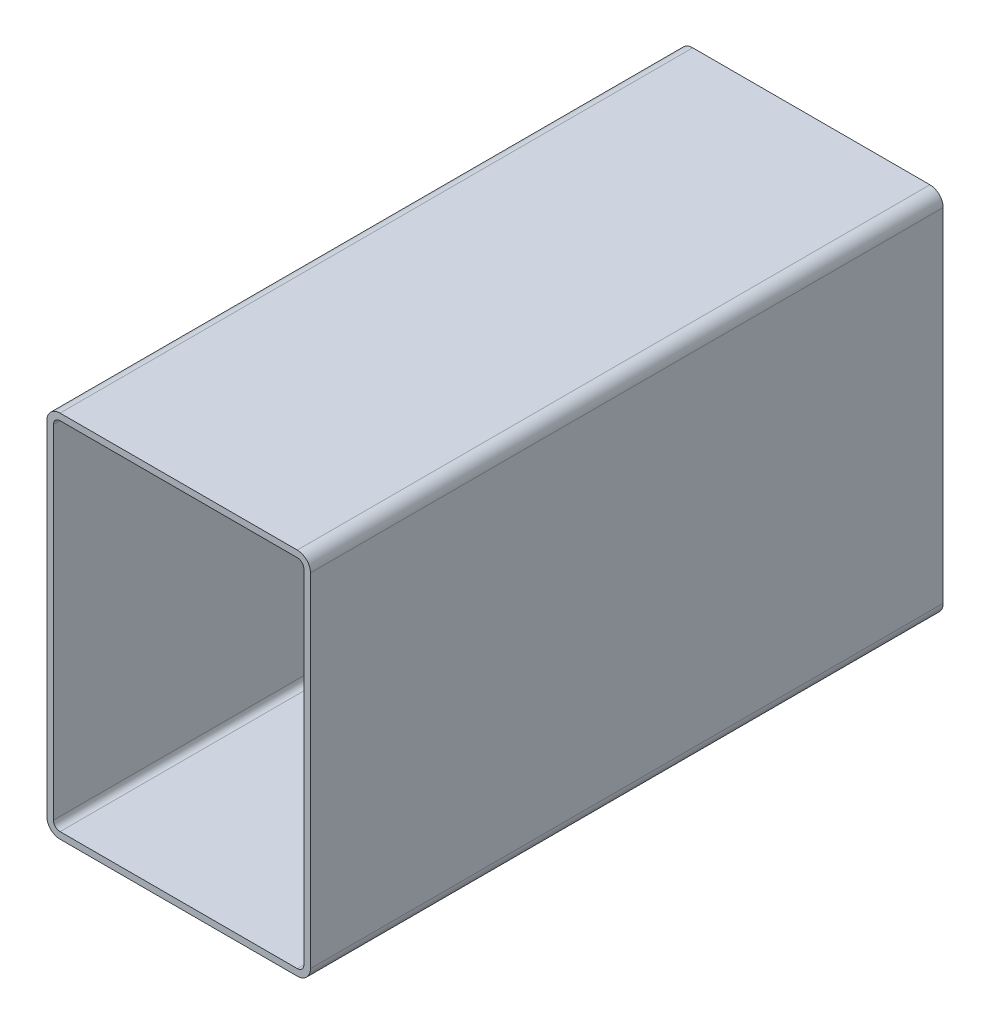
SolidWorks part; units mm, degrees
ref_plane "Front Plane" through (0, 0, 0) normal (0, 0, 1) x (1, 0, 0)
ref_plane "Top Plane" through (0, 0, 0) normal (0, 1, 0) x (1, 0, 0)
ref_plane "Right Plane" through (0, 0, 0) normal (1, 0, 0) x (0, 0, -1)
sketch "Sketch1" plane through (0, 0, 0) normal (0, 0, 1) x (1, 0, 0)
sketch_block_instance "HSS7x5x0.125-1"
sketch_block "HSS7x5x0.125"
extrude "Boss-Extrude1" add sketch "Sketch1" along normal blind 304.8
